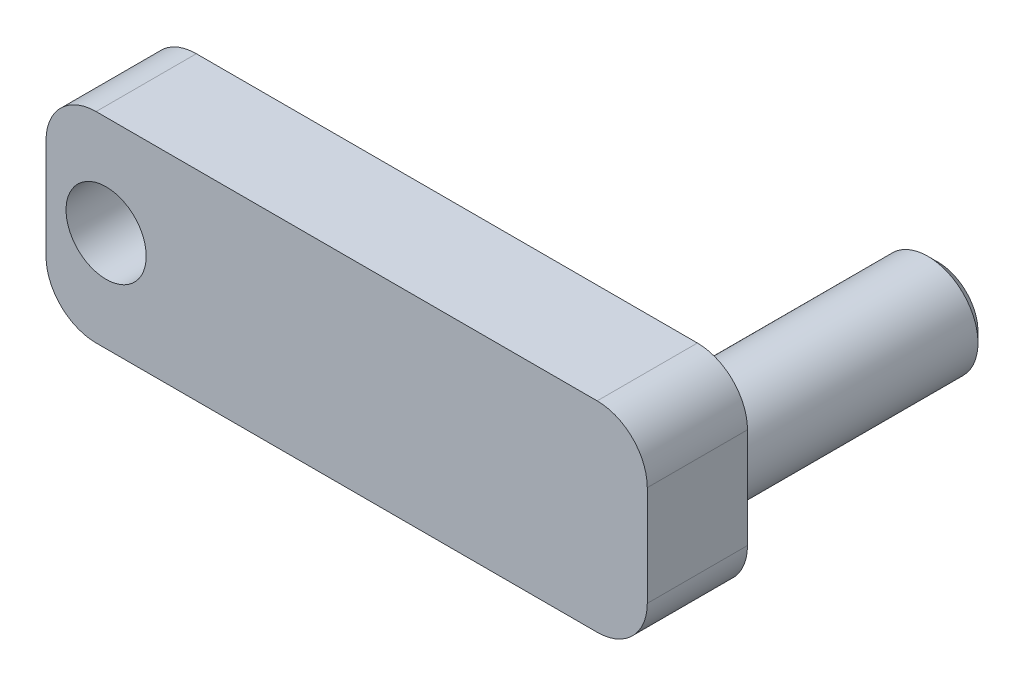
SolidWorks part; units mm, degrees
ref_plane "Frontal" through (0, 0, 0) normal (0, 0, 1) x (1, 0, 0)
ref_plane "Superior" through (0, 0, 0) normal (0, 1, 0) x (1, 0, 0)
ref_plane "Derecha" through (0, 0, 0) normal (1, 0, 0) x (0, 0, -1)
sketch "Croquis1" plane through (0, 0, 0) normal (0, 0, 1) x (1, 0, 0)
  line L1 (-20, 10) -> (30, 10)
  line L2 (-25, 5) -> (-25, -5)
  line L3 (-20, -10) -> (30, -10)
  line L4 (35, 5) -> (35, -5)
  arc A0 (30, 10) -> (35, 5) centre (30, 5) cw
  arc A1 (30, -10) -> (35, -5) centre (30, -5) ccw
  arc A2 (-25, -5) -> (-20, -10) centre (-20, -5) ccw
  arc A3 (-20, 10) -> (-25, 5) centre (-20, 5) ccw
  point P7 (35, 10)
  point P10 (35, -10)
  point P15 (-25, 10)
  dimension "D5" = 5
  dimension "D1" = 20
  dimension "D2" = 10
  dimension "D3" = 60
  dimension "D4" = 25
extrude "Extruir1" add sketch "Croquis1" along normal blind 10
sketch "Croquis2" plane through (0, 0, 0) normal (0, 0, -1) x (-1, 0, 0)
  line L0 (-35, -5) -> (-35, 5) construction
  circle A0 centre (-29, 0) radius 5
  dimension "D1" = 10
  dimension "D2" = 6
extrude "Extruir2" add sketch "Croquis2" along normal blind 25
sketch "Croquis3" plane through (0, 0, 10) normal (0, 0, 1) x (1, 0, 0)
  line L0 (-25, 5) -> (-25, -5) construction
  circle A0 centre (-19, 0) radius 4
  dimension "D1" = 8
  dimension "D2" = 6
extrude "Cortar-Extruir1" cut sketch "Croquis3" against normal blind 40
chamfer "Chaflán2" distance 1 angle 45 1 edges at (24, 0, -25)
